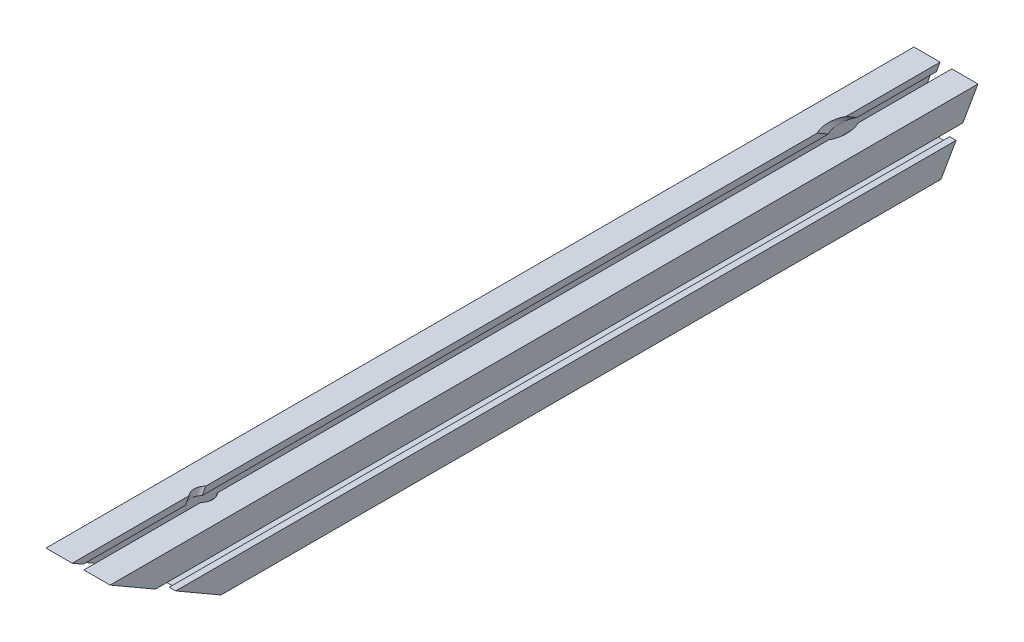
SolidWorks part; units mm, degrees
ref_plane "Front Plane" through (0, 0, 0) normal (0, 0, 1) x (1, 0, 0)
ref_plane "Top Plane" through (0, 0, 0) normal (0, 1, 0) x (1, 0, 0)
ref_plane "Right Plane" through (0, 0, 0) normal (1, 0, 0) x (0, 0, -1)
sketch "Sketch1" plane through (0, 0, 0) normal (0, 0, 1) x (1, 0, 0)
  line L4 (-20.5, 8.8) -> (-20.5, 15.5)
  line L5 (-13.8, 8.8) -> (-20.5, 8.8)
  line L6 (-8.8, 20.5) -> (-8.8, 13.8)
  line L7 (-15.5, 20.5) -> (-8.8, 20.5)
  line L12 (20.5, 8.8) -> (13.8, 8.8)
  line L13 (20.5, 15.5) -> (20.5, 8.8)
  line L14 (8.8, 20.5) -> (15.5, 20.5)
  line L15 (8.8, 13.8) -> (8.8, 20.5)
  line L20 (15.5, -20.5) -> (8.8, -20.5)
  line L21 (20.5, -8.8) -> (20.5, -15.5)
  line L22 (13.8, -8.8) -> (20.5, -8.8)
  line L23 (8.8, -20.5) -> (8.8, -13.8)
  line L28 (-8.8, -20.5) -> (-15.5, -20.5)
  line L29 (-8.8, -13.8) -> (-8.8, -20.5)
  line L30 (-20.5, -8.8) -> (-13.8, -8.8)
  line L31 (-20.5, -15.5) -> (-20.5, -8.8)
  line L88 (-18, -6.8) -> (-18, -4.1)
  line L89 (-18, -4.1) -> (-22.5, -4.1)
  line L90 (-22.5, -4.1) -> (-22.5, -22.5)
  line L91 (-22.5, -22.5) -> (-4.1, -22.5)
  line L92 (-4.1, -22.5) -> (-4.1, -18)
  line L93 (-4.1, -18) -> (-6.8, -18)
  line L94 (-6.8, -18) -> (-6.8, -9.5)
  line L95 (-6.8, -9.5) -> (-4.5, -7.2)
  line L96 (-4.5, -7.2) -> (4.5, -7.2)
  line L97 (4.5, -7.2) -> (6.8, -9.5)
  line L98 (6.8, -9.5) -> (6.8, -18)
  line L99 (6.8, -18) -> (4.1, -18)
  line L100 (4.1, -18) -> (4.1, -22.5)
  line L101 (4.1, -22.5) -> (22.5, -22.5)
  line L102 (22.5, -22.5) -> (22.5, -4.1)
  line L103 (22.5, -4.1) -> (18, -4.1)
  line L104 (18, -4.1) -> (18, -6.8)
  line L105 (18, -6.8) -> (9.5, -6.8)
  line L106 (9.5, -6.8) -> (7.2, -4.5)
  line L107 (7.2, -4.5) -> (7.2, 4.5)
  line L108 (7.2, 4.5) -> (9.5, 6.8)
  line L109 (9.5, 6.8) -> (18, 6.8)
  line L110 (18, 6.8) -> (18, 4.1)
  line L111 (18, 4.1) -> (22.5, 4.1)
  line L112 (22.5, 4.1) -> (22.5, 22.5)
  line L113 (22.5, 22.5) -> (4.1, 22.5)
  line L114 (4.1, 22.5) -> (4.1, 18)
  line L115 (4.1, 18) -> (6.8, 18)
  line L116 (6.8, 18) -> (6.8, 9.5)
  line L117 (6.8, 9.5) -> (4.5, 7.2)
  line L118 (4.5, 7.2) -> (-4.5, 7.2)
  line L119 (-4.5, 7.2) -> (-6.8, 9.5)
  line L120 (-6.8, 9.5) -> (-6.8, 18)
  line L121 (-6.8, 18) -> (-4.1, 18)
  line L122 (-4.1, 18) -> (-4.1, 22.5)
  line L123 (-4.1, 22.5) -> (-22.5, 22.5)
  line L124 (-22.5, 22.5) -> (-22.5, 4.1)
  line L125 (-22.5, 4.1) -> (-18, 4.1)
  line L126 (-18, 4.1) -> (-18, 6.8)
  line L127 (-18, 6.8) -> (-9.5, 6.8)
  line L128 (-9.5, 6.8) -> (-7.2, 4.5)
  line L129 (-7.2, 4.5) -> (-7.2, -4.5)
  line L130 (-7.2, -4.5) -> (-9.5, -6.8)
  line L131 (-9.5, -6.8) -> (-18, -6.8)
  line L132 (-3.2627, 1.8485) -> (-4.5962, 3.182)
  line L133 (-4.5962, -3.182) -> (-3.2627, -1.8485)
  line L134 (-3.182, -4.5962) -> (-4.5962, -3.182)
  line L135 (-1.8485, -3.2627) -> (-3.182, -4.5962)
  line L136 (3.182, -4.5962) -> (1.8485, -3.2627)
  line L137 (4.5962, -3.182) -> (3.182, -4.5962)
  line L138 (3.2627, -1.8485) -> (4.5962, -3.182)
  line L139 (4.5962, 3.182) -> (3.2627, 1.8485)
  line L140 (3.182, 4.5962) -> (4.5962, 3.182)
  line L141 (1.8485, 3.2627) -> (3.182, 4.5962)
  line L142 (-3.182, 4.5962) -> (-1.8485, 3.2627)
  line L143 (-4.5962, 3.182) -> (-3.182, 4.5962)
  arc A2 (-13.8, 8.8) -> (-8.8, 13.8) centre (-13.8, 13.8) ccw
  arc A3 (-15.5, 20.5) -> (-20.5, 15.5) centre (-15.5, 15.5) ccw
  arc A6 (8.8, 13.8) -> (13.8, 8.8) centre (13.8, 13.8) ccw
  arc A7 (20.5, 15.5) -> (15.5, 20.5) centre (15.5, 15.5) ccw
  arc A10 (15.5, -20.5) -> (20.5, -15.5) centre (15.5, -15.5) ccw
  arc A11 (13.8, -8.8) -> (8.8, -13.8) centre (13.8, -13.8) ccw
  arc A14 (-20.5, -15.5) -> (-15.5, -20.5) centre (-15.5, -15.5) ccw
  arc A15 (-8.8, -13.8) -> (-13.8, -8.8) centre (-13.8, -13.8) ccw
  arc A20 (-3.2627, 1.8485) -> (-3.2627, -1.8485) centre (0, 0) ccw
  arc A21 (-1.8485, -3.2627) -> (1.8485, -3.2627) centre (0, 0) ccw
  arc A22 (3.2627, -1.8485) -> (3.2627, 1.8485) centre (0, 0) ccw
  arc A23 (1.8485, 3.2627) -> (-1.8485, 3.2627) centre (0, 0) ccw
extrude "Boss-Extrude1" add sketch "Sketch1" against normal mid plane 609.6 contours L7 A3 L4 L5 A2 L6 | L13 A7 L14 L15 A6 L12 | L141 A23 L142 L143 L132 A20 L133 L134 L135 A21 L136 L137 L138 A22 L139 L140 | L29 A15 L30 L31 A14 L28 | L22 A11 L23 L20 A10 L21 | L123 L124 L125 L126 L127 L128 L129 L130 L131 L88 L89 L90 L91 L92 L93 L94 L95 L96 L97 L98 L99 L100 L101 L102 L103 L104 L105 L106 L107 L108 L109 L110 L111 L112 L113 L114 L115 L116 L117 L118 L119 L120 L121 L122
sketch "Sketch2" plane through (22.5, 0, 0) normal (1, 0, 0) x (0, 0, -1)
  line L0 (-304.8, 22.5) -> (-226.8577, -22.5)
  line L1 (304.8, -22.5) -> (-304.8, -22.5) construction
  line L2 (-226.8577, -22.5) -> (-304.8, -22.5)
  line L3 (-304.8, -22.5) -> (-304.8, 22.5)
  line L4 (304.8, 22.5) -> (278.8192, -22.5)
  line L5 (278.8192, -22.5) -> (304.8, -22.5)
  line L6 (304.8, -22.5) -> (304.8, 22.5)
  dimension "D1" = 30
  dimension "D2" = 30
extrude "Cut-Extrude1" cut sketch "Sketch2" against normal blind 609.6
sketch "Sketch3" plane through (0, -126.3573, -218.8572) normal (0, -0.5, -0.866) x (-1, 0, 0)
  line L0 (-22.5, 141.1705) -> (-22.5, 119.924) construction
  line L1 (4.1, 171.8856) -> (22.5, 171.8856) construction
  circle A0 centre (0, 133.7856) radius 4.25
  dimension "D1" = 8.5
  dimension "D2" = 22.5
  dimension "D3" = 38.1
extrude "Cut-Extrude2" cut sketch "Sketch3" against normal blind 609.6
ref_plane "Plane1" through (0, -115.5623, -200.1597) normal (0, -0.5, -0.866) x (-1, 0, 0)
sketch "Sketch4" plane through (0, -115.5623, -200.1597) normal (0, -0.5, -0.866) x (-1, 0, 0)
  circle A0 centre (0, 133.7856) radius 6.5
  dimension "D1" = 13
extrude "Cut-Extrude3" cut sketch "Sketch4" against normal blind 609.6
sketch "Sketch5" plane through (0, -115.1073, 66.4572) normal (0, -0.866, 0.5) x (1, 0, 0)
  line L0 (22.5, 275.2145) -> (4.1, 275.2145) construction
  line L2 (22.5, 238.4145) -> (22.5, 275.2145) construction
  circle A0 centre (0, 199.0145) radius 4.25
  dimension "D1" = 8.5
  dimension "D2" = 76.2
  dimension "D3" = 22.5
extrude "Cut-Extrude4" cut sketch "Sketch5" against normal blind 609.6
ref_plane "Plane2" through (0, -96.4098, 55.6622) normal (0, -0.866, 0.5) x (-1, 0, 0)
sketch "Sketch6" plane through (0, -96.4098, 55.6622) normal (0, -0.866, 0.5) x (-1, 0, 0)
  circle A0 centre (0, -199.0145) radius 6.5
  dimension "D1" = 13
extrude "Cut-Extrude5" cut sketch "Sketch6" against normal blind 609.6 contours A0
